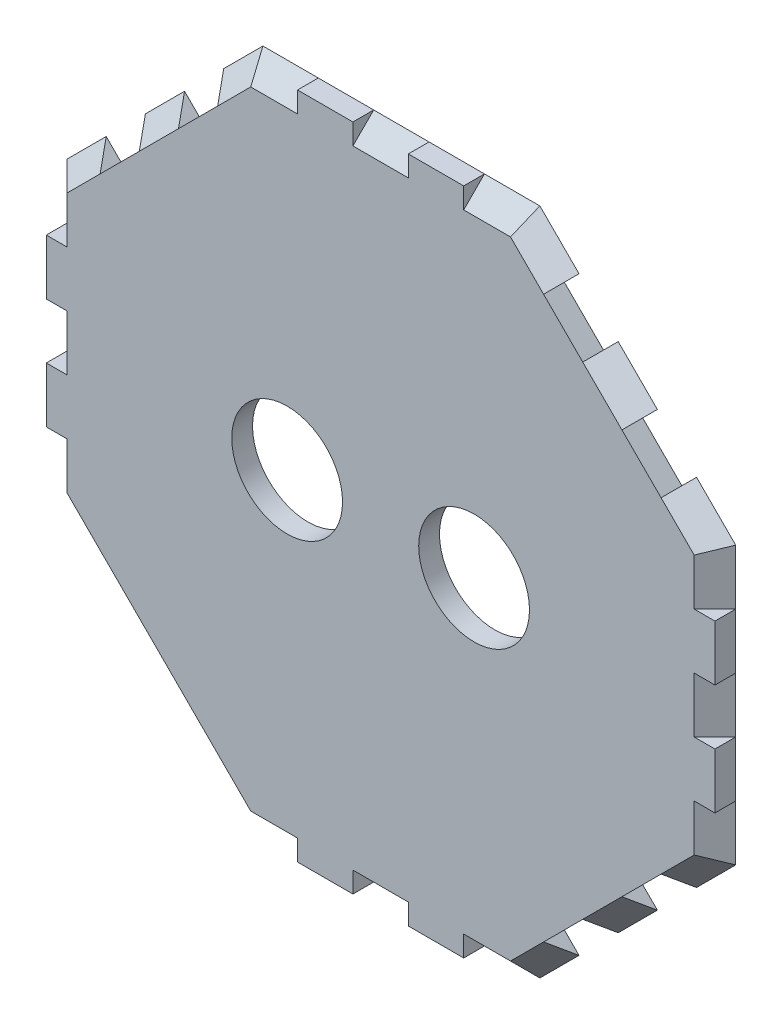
SolidWorks part; units mm, degrees
ref_plane "Alzado" through (0, 0, 0) normal (0, 0, 1) x (1, 0, 0)
ref_plane "Planta" through (0, 0, 0) normal (0, 1, 0) x (1, 0, 0)
ref_plane "Vista lateral" through (0, 0, 0) normal (1, 0, 0) x (0, 0, -1)
sketch "Croquis1" plane through (0, 0, 0) normal (0, 0, 1) x (1, 0, 0)
  line L1 (48.2843, 20) -> (20, 48.2843)
  line L2 (20, 48.2843) -> (-20, 48.2843)
  line L3 (-20, 48.2843) -> (-48.2843, 20)
  line L4 (-48.2843, 20) -> (-48.2843, -20)
  line L5 (-48.2843, -20) -> (-20, -48.2843)
  line L6 (-20, -48.2843) -> (20, -48.2843)
  line L7 (20, -48.2843) -> (48.2843, -20)
  line L8 (48.2843, -20) -> (48.2843, 20)
  circle A0 centre (0, 0) radius 48.2843 construction
  dimension "D1" = 40
extrude "Saliente-Extruir1" add sketch "Croquis1" along normal blind 3
chamfer "Chaflán1" distance 3 angle 45 8 edges at (-34.1421, -34.1421, 3) (-48.2843, 0, 3) (0, -48.2843, 3) (34.1421, -34.1421, 3) (48.2843, 0, 3) (34.1421, 34.1421, 3) (0, 48.2843, 3) (-34.1421, 34.1421, 3)
sketch "Croquis3" plane through (0, 0, 0) normal (0, 0, -1) x (-1, 0, 0)
  line L1 (-20, 48.2843) -> (20, 48.2843) construction
  line L3 (4, 48.2843) -> (4, 45.2843)
  line L4 (4, 45.2843) -> (12, 45.2843)
  line L5 (12, 45.2843) -> (12, 48.2843)
  line L6 (12, 48.2843) -> (4, 48.2843)
  line L7 (-4, 48.2843) -> (-4, 45.2843)
  line L8 (-4, 45.2843) -> (-12, 45.2843)
  line L9 (-12, 45.2843) -> (-12, 48.2843)
  line L10 (-12, 48.2843) -> (-4, 48.2843)
  line L11 (-12, -48.2843) -> (-4, -48.2843)
  line L12 (-12, -45.2843) -> (-12, -48.2843)
  line L13 (-4, -45.2843) -> (-12, -45.2843)
  line L14 (-4, -48.2843) -> (-4, -45.2843)
  line L15 (12, -48.2843) -> (4, -48.2843)
  line L16 (12, -45.2843) -> (12, -48.2843)
  line L17 (4, -45.2843) -> (12, -45.2843)
  line L18 (4, -48.2843) -> (4, -45.2843)
  line L20 (-48.2843, 4) -> (-45.2843, 4)
  line L21 (-45.2843, 4) -> (-45.2843, 12)
  line L22 (-45.2843, 12) -> (-48.2843, 12)
  line L23 (-48.2843, 12) -> (-48.2843, 4)
  line L24 (-48.2843, -4) -> (-45.2843, -4)
  line L25 (-45.2843, -4) -> (-45.2843, -12)
  line L26 (-45.2843, -12) -> (-48.2843, -12)
  line L27 (-48.2843, -12) -> (-48.2843, -4)
  line L28 (48.2843, -12) -> (48.2843, -4)
  line L29 (45.2843, -12) -> (48.2843, -12)
  line L30 (45.2843, -4) -> (45.2843, -12)
  line L31 (48.2843, -4) -> (45.2843, -4)
  line L32 (48.2843, 12) -> (48.2843, 4)
  line L33 (45.2843, 12) -> (48.2843, 12)
  line L34 (45.2843, 4) -> (45.2843, 12)
  line L35 (48.2843, 4) -> (45.2843, 4)
extrude "Saliente-Extruir2" add sketch "Croquis3" against normal blind 3
sketch "Croquis4" plane through (0, 0, 0) normal (0, 0, -1) x (-1, 0, 0)
  line L1 (-48.2843, 20) -> (-20, 48.2843) construction
  line L3 (-31.3137, 36.9706) -> (-29.1924, 34.8492)
  line L4 (-29.1924, 34.8492) -> (-23.5355, 40.5061)
  line L5 (-23.5355, 40.5061) -> (-25.6569, 42.6274)
  line L6 (-25.6569, 42.6274) -> (-31.3137, 36.9706)
  line L7 (-36.9706, 31.3137) -> (-34.8492, 29.1924)
  line L8 (-34.8492, 29.1924) -> (-40.5061, 23.5355)
  line L9 (-40.5061, 23.5355) -> (-42.6274, 25.6569)
  line L10 (-42.6274, 25.6569) -> (-36.9706, 31.3137)
  line L11 (-42.6274, -25.6569) -> (-36.9706, -31.3137)
  line L12 (-40.5061, -23.5355) -> (-42.6274, -25.6569)
  line L13 (-34.8492, -29.1924) -> (-40.5061, -23.5355)
  line L14 (-36.9706, -31.3137) -> (-34.8492, -29.1924)
  line L15 (-25.6569, -42.6274) -> (-31.3137, -36.9706)
  line L16 (-23.5355, -40.5061) -> (-25.6569, -42.6274)
  line L17 (-29.1924, -34.8492) -> (-23.5355, -40.5061)
  line L18 (-31.3137, -36.9706) -> (-29.1924, -34.8492)
  line L20 (31.3137, -36.9706) -> (29.1924, -34.8492)
  line L21 (29.1924, -34.8492) -> (23.5355, -40.5061)
  line L22 (23.5355, -40.5061) -> (25.6569, -42.6274)
  line L23 (25.6569, -42.6274) -> (31.3137, -36.9706)
  line L24 (36.9706, -31.3137) -> (34.8492, -29.1924)
  line L25 (34.8492, -29.1924) -> (40.5061, -23.5355)
  line L26 (40.5061, -23.5355) -> (42.6274, -25.6569)
  line L27 (42.6274, -25.6569) -> (36.9706, -31.3137)
  line L28 (42.6274, 25.6569) -> (36.9706, 31.3137)
  line L29 (40.5061, 23.5355) -> (42.6274, 25.6569)
  line L30 (34.8492, 29.1924) -> (40.5061, 23.5355)
  line L31 (36.9706, 31.3137) -> (34.8492, 29.1924)
  line L32 (25.6569, 42.6274) -> (31.3137, 36.9706)
  line L33 (23.5355, 40.5061) -> (25.6569, 42.6274)
  line L34 (29.1924, 34.8492) -> (23.5355, 40.5061)
  line L35 (31.3137, 36.9706) -> (29.1924, 34.8492)
extrude "Cortar-Extruir1" cut sketch "Croquis4" against normal blind 3
sketch "Croquis5" plane through (0, 0, 0) normal (0, 0, -1) x (-1, 0, 0)
  circle A0 centre (13.5, 0) radius 8
  circle A1 centre (-13.5, 0) radius 8
extrude "Cortar-Extruir2" cut sketch "Croquis5" against normal blind 10
